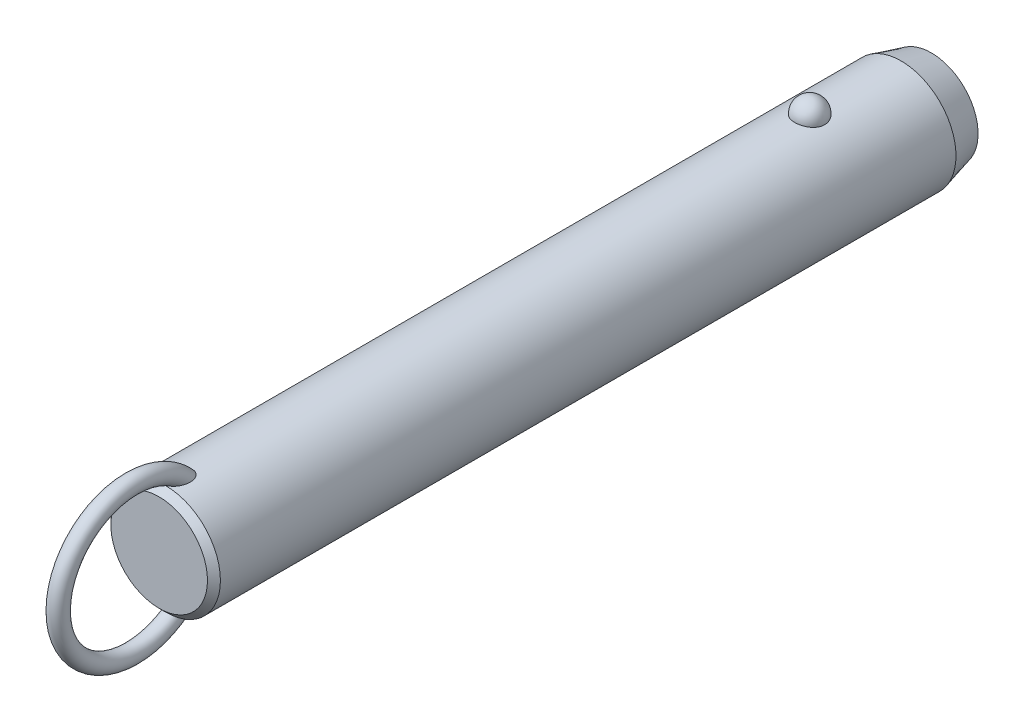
SolidWorks part; units mm, degrees
ref_plane "Front Plane" through (0, 0, 0) normal (0, 0, 1) x (1, 0, 0)
ref_plane "Top Plane" through (0, 0, 0) normal (0, 1, 0) x (1, 0, 0)
ref_plane "Right Plane" through (0, 0, 0) normal (1, 0, 0) x (0, 0, -1)
sketch "Sketch2" plane through (0, 0, 0) normal (0, 0, 1) x (1, 0, 0)
  circle A0 centre (0, 0) radius 12.7
  point P3 (0, 12.7)
  dimension "D1" = 25.4
extrude "Boss-Extrude1" add sketch "Sketch2" along normal blind 134.6
sketch "Sketch3" plane through (0, 0, 0) normal (0, 0, -1) x (-1, 0, 0)
  circle A0 centre (0, 0) radius 12.7
  dimension "D1" = 25.4
extrude "Boss-Extrude2" add sketch "Sketch3" along normal blind 31.7
chamfer "Chamfer1" distance 7 angle 15 1 edges at (-12.7, 0, -31.7)
sketch "Sketch12" plane through (0, 0, 0) normal (1, 0, 0) x (0, 0, -1)
  line L0 (-134.6, 12.7) -> (-134.6, -12.7) construction
  point P0 (-134.6, 0)
sketch "Sketch13" plane through (0, 0, 0) normal (1, 0, 0) x (0, 0, -1)
  circle A0 centre (-153.65, 0) radius 19.05
  point P2 (-134.6, 0)
  dimension "D1" = 38.1
sketch "Sketch14" plane through (0, 0, 0) normal (0, 1, 0) x (1, 0, 0)
  circle A0 centre (0, -136.6) radius 2
  point P2 (0, -134.6)
  dimension "D1" = 4
sweep "Sweep1" add profiles "Sketch14" path "Sketch13"
sketch "Sketch15" plane through (0, 0, 134.6) normal (0, 0, 1) x (1, 0, 0)
  circle A0 centre (0, 0) radius 12.7
  dimension "D1" = 25.4
extrude "Boss-Extrude3" add sketch "Sketch15" along normal blind 12.7
chamfer "Chamfer2" distance 1.5 angle 45 1 edges at (12.7, 0, 147.3)
sketch "Sketch18" plane through (0, 0, 0) normal (1, 0, 0) x (0, 0, -1)
  line L0 (24.7, 12.7) -> (-139.451, 12.7) construction
  line L1 (3.5, 16.2) -> (3.5, 9.2)
  line L2 (-139.451, -12.7) -> (24.7, -12.7) construction
  arc A0 (3.5, 16.2) -> (3.5, 9.2) centre (3.5, 12.7) ccw
  point P4 (0, 12.7)
  dimension "D1" = 28.9
revolve "Revolve1" add sketch "Sketch18" angle 360 about L1
